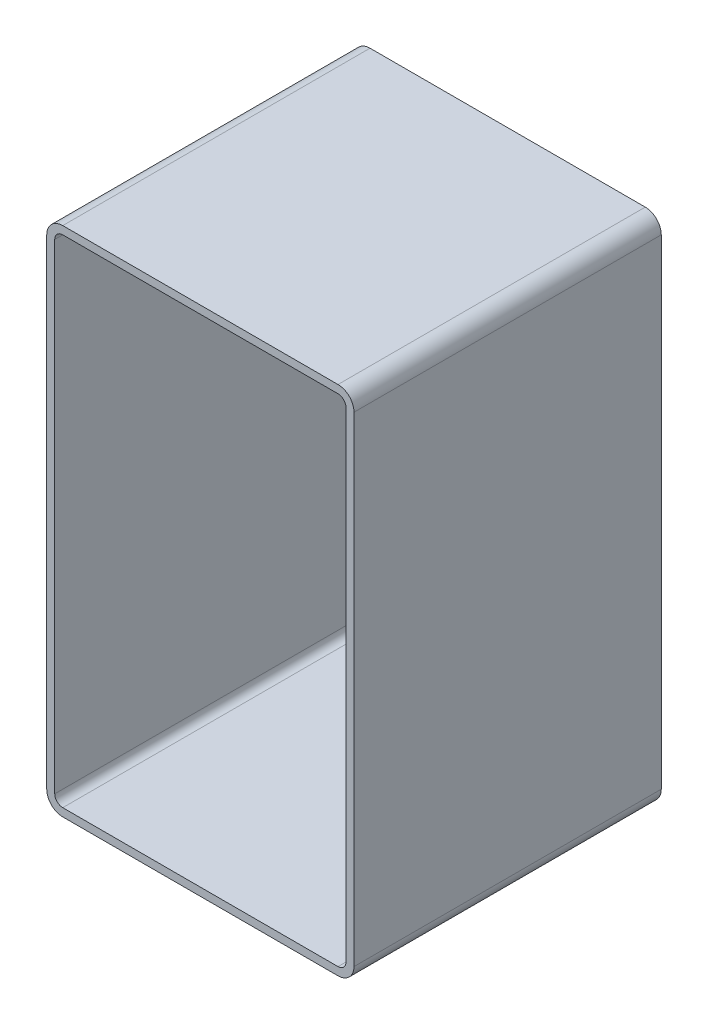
SolidWorks part; units mm, degrees
ref_plane "Front Plane" through (0, 0, 0) normal (0, 0, 1) x (1, 0, 0)
ref_plane "Top Plane" through (0, 0, 0) normal (0, 1, 0) x (1, 0, 0)
ref_plane "Right Plane" through (0, 0, 0) normal (1, 0, 0) x (0, 0, -1)
sketch "Sketch1" plane through (0, 0, 0) normal (0, 0, 1) x (1, 0, 0)
sketch_block_instance "HSS20x12x0.3125 (1)-1"
sketch_block "HSS20x12x0.3125 (1)"
extrude "Boss-Extrude1" add sketch "Sketch1" along normal blind 304.8
